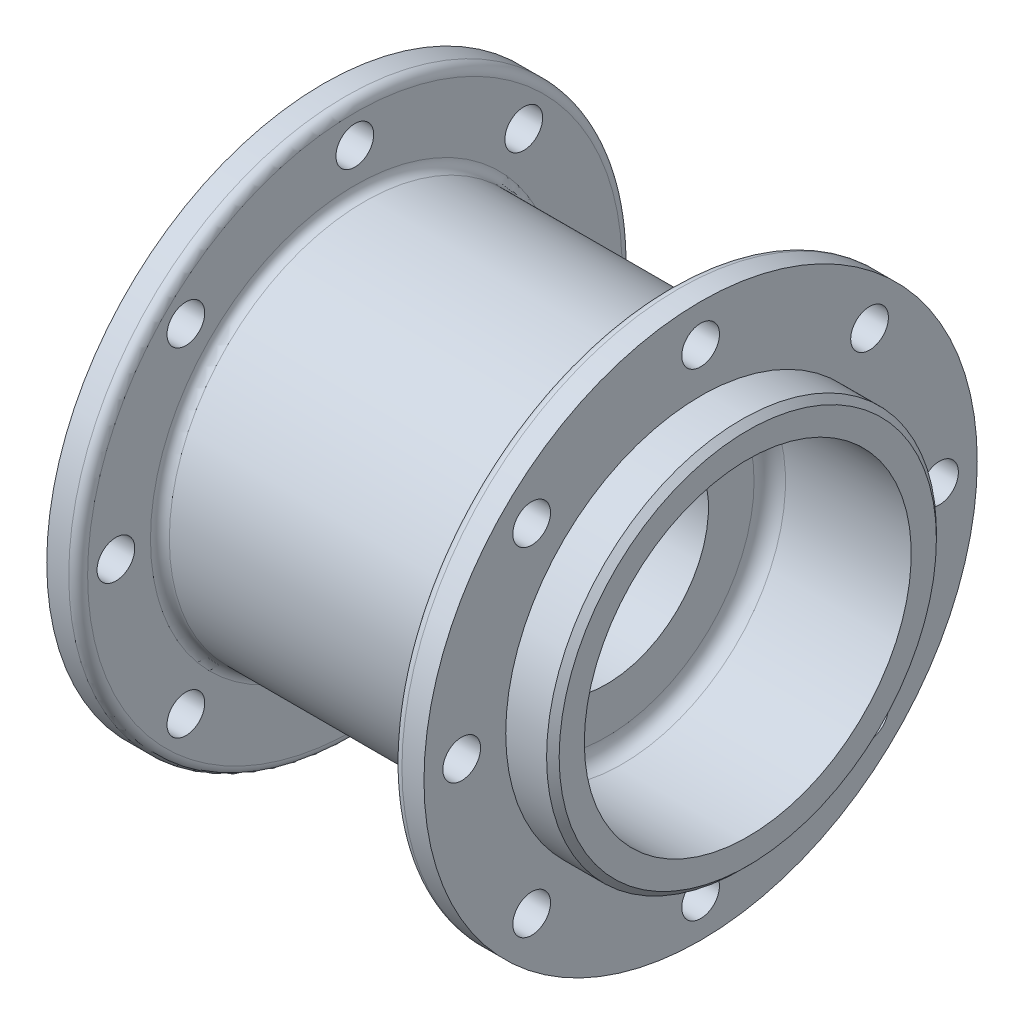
SolidWorks part; units mm, degrees
ref_plane "Plan de face" through (0, 0, 0) normal (0, 0, 1) x (1, 0, 0)
ref_plane "Plan de dessus" through (0, 0, 0) normal (0, 1, 0) x (1, 0, 0)
ref_plane "Plan de droite" through (0, 0, 0) normal (1, 0, 0) x (0, 0, -1)
sketch "Esquisse1" plane through (0, 0, 0) normal (0, 0, 1) x (1, 0, 0)
  line L0 (0, 62) -> (15, 62)
  line L1 (15, 62) -> (15, 88)
  line L2 (15, 88) -> (25, 88)
  line L3 (25, 88) -> (25, 62)
  line L4 (25, 62) -> (125, 62)
  line L5 (0, 62) -> (0, 52)
  line L6 (0, 52) -> (45, 52)
  line L7 (125, 62) -> (125, 88)
  line L8 (125, 88) -> (135, 88)
  line L9 (135, 88) -> (135, 62)
  line L10 (135, 62) -> (150, 62)
  line L11 (150, 62) -> (150, 52)
  line L12 (-29.1372, 0) -> (148.0116, 0) construction
  line L13 (45, 52) -> (45, 32.5)
  line L14 (45, 32.5) -> (105, 32.5)
  line L15 (105, 32.5) -> (105, 52)
  line L16 (105, 52) -> (150, 52)
  dimension "D1" = 104
  dimension "D2" = 124
  dimension "D3" = 15
  dimension "D4" = 176
  dimension "D5" = 100
  dimension "D6" = 10
  dimension "D7" = 65
  dimension "D8" = 20
  dimension "D9" = 20
revolve "Révolution1" add sketch "Esquisse1" angle 360 about L12
chamfer "Chanfrein1" distance 2 angle 45 2 edges at (0, 0, 62) (150, 0, 62)
fillet "Congé1" radius 3 4 edges at (125, 0, 88) (25, 0, 88) (125, 0, 62) (25, 0, 62)
sketch "Esquisse2" plane through (15, 0, 0) normal (-1, 0, 0) x (0, 0, 1)
  line L0 (-116.484, 0) -> (145.6411, 0) construction
  line L1 (0, 95.8431) -> (0, -95.5544) construction
  line L2 (-81.2575, -81.2575) -> (87.8041, 87.8041) construction
  line L3 (105.9448, -105.9448) -> (-76.5848, 76.5848) construction
  circle A0 centre (0, 0) radius 76 construction
  circle A1 centre (-53.7401, 53.7401) radius 6
  circle A2 centre (0, 76) radius 6
  circle A3 centre (53.7401, 53.7401) radius 6
  circle A4 centre (76, 0) radius 6
  circle A5 centre (53.7401, -53.7401) radius 6
  circle A6 centre (0, -76) radius 6
  circle A7 centre (-53.7401, -53.7401) radius 6
  circle A8 centre (-76, 0) radius 6
  dimension "D3" = 152
  dimension "D4" = 12
  dimension "D1" = 45
  dimension "D2" = 45
extrude "Extrusion1" cut sketch "Esquisse2" against normal through all
fillet "Congé2" radius 5 2 edges at (105, 0, 52) (45, 0, 52)
